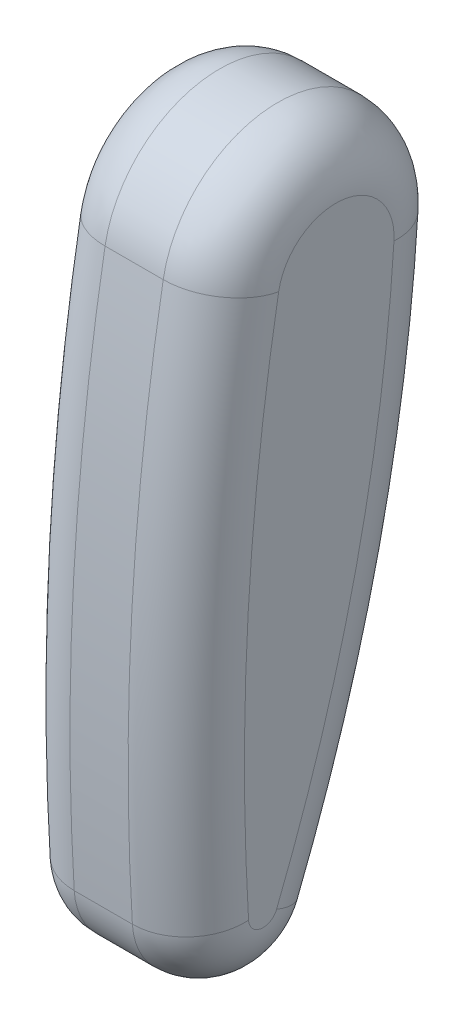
SolidWorks part; units mm, degrees
ref_plane "XY" through (0, 0, 0) normal (0, 0, 1) x (1, 0, 0)
ref_plane "YZ" through (0, 0, 0) normal (0, 1, 0) x (1, 0, 0)
ref_plane "XZ" through (0, 0, 0) normal (1, 0, 0) x (0, 0, -1)
ref_plane "Leg-plane" through (114.3, 0, 0) normal (1, 0, 0) x (0, 0, -1)
sketch "Sketch6" plane through (114.3, 0, 0) normal (1, 0, 0) x (0, 0, -1)
  line L0 (-24.1632, -755.7123) -> (39.4667, -302.9618) construction
  line L1 (0, 432.2232) -> (0, -432.2232) construction
  arc A0 (140.8633, -309.3875) -> (-60.6009, -285.3826) centre (39.4667, -302.9618) ccw
  arc A1 (-87.5476, -759.5429) -> (34.7899, -779.3084) centre (-24.1632, -755.7123) ccw
  arc A2 (-87.5476, -759.5429) -> (-60.6009, -285.3826) centre (1940.7519, -636.9659) cw
  arc A3 (140.8633, -309.3875) -> (34.7899, -779.3084) centre (-1380.0857, -213.0019) cw
  dimension "D3" = 101.6
  dimension "D4" = 1524
  dimension "D5" = 2032
  dimension "D6" = 63.5
  dimension "D1" = 457.2
  dimension "D2" = 8
extrude "Base-Extrude" add sketch "Sketch6" along normal mid plane 152.4
fillet "Fillet1" radius 50.8 8 edges at (190.5, -548.5657, -106.5121) (190.5, -202.0754, -51.4875) (190.5, -521.6728, 87.9746) (38.1, -202.0754, -51.4875) (38.1, -548.5657, -106.5121) (38.1, -818.3994, 34.2913) (38.1, -521.6728, 87.9746) (190.5, -818.3994, 34.2913)
